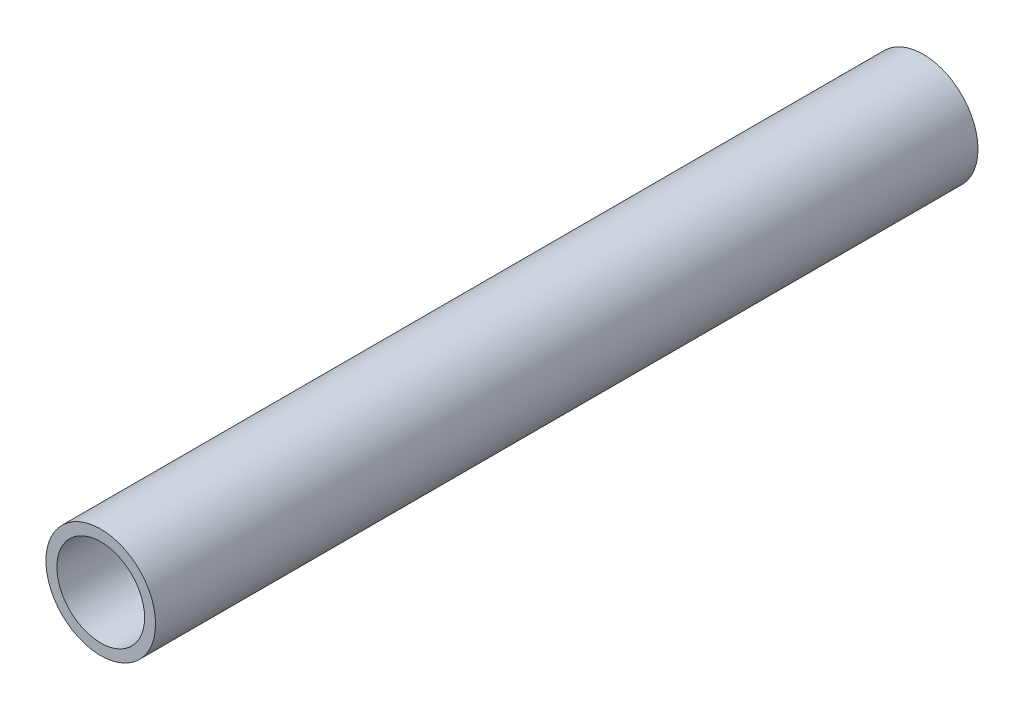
SolidWorks part; units mm, degrees
ref_plane "Plan1" through (0, 0, 0) normal (0, 0, 1) x (1, 0, 0)
ref_plane "Plan2" through (0, 0, 0) normal (0, 1, 0) x (1, 0, 0)
ref_plane "Plan3" through (0, 0, 0) normal (1, 0, 0) x (0, 0, -1)
sketch "Esquisse1" plane through (0, 0, 0) normal (0, 0, 1) x (1, 0, 0)
  circle A0 centre (0, 0) radius 10
  circle A1 centre (0, 0) radius 8
extrude "Base-Extrusion" add sketch "Esquisse1" along normal blind 150
